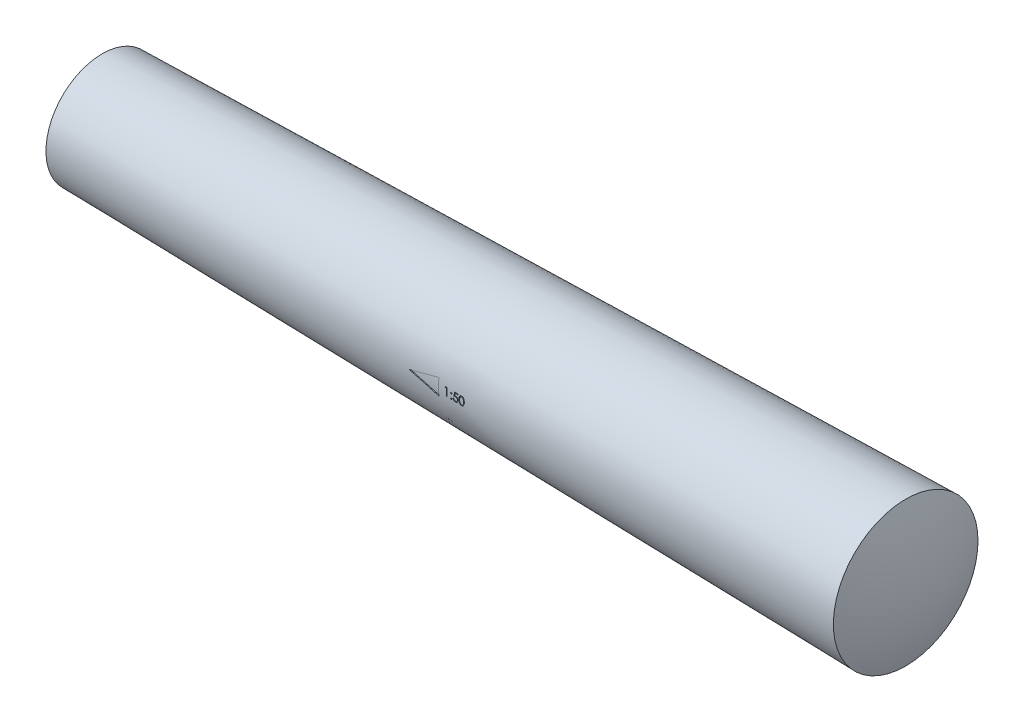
SolidWorks part; units mm, degrees
ref_plane "Front Plane" through (0, 0, 0) normal (0, 0, 1) x (1, 0, 0)
ref_plane "Top Plane" through (0, 0, 0) normal (0, 1, 0) x (1, 0, 0)
ref_plane "Right Plane" through (0, 0, 0) normal (1, 0, 0) x (0, 0, -1)
sketch "Sketch1" plane through (0, 0, 0) normal (1, 0, 0) x (0, 0, -1)
  circle A0 centre (0, 0) radius 7
  dimension "D1" = 14
extrude "Extrude1" add sketch "Sketch1" along normal mid plane 100
draft "Draft1" type of draft neutral plane draft angle 1.146 faces to draft 1 parameters "D1"=1.146
sketch "Sketch2" plane through (0, 0, 0) normal (0, 0, 1) x (1, 0, 0)
  line L0 (-50, 0) -> (-50, 7)
  line L1 (-50, 7) -> (-50, -7) construction
  line L2 (-50, 0) -> (-51.6, 0)
  line L3 (-51.6, 0) -> (-51.6, -8) construction
  line L4 (50, 0) -> (50, 9.0001)
  line L5 (50, -9.0001) -> (50, 9.0001) construction
  line L6 (50, 0) -> (51.6, 0)
  line L7 (51.6, 0) -> (51.6, -8) construction
  line L8 (-50, -7) -> (50, -9.0001) construction
  arc A0 (-51.6, 0) -> (-50, 7) centre (-35.4875, 0) cw
  arc A1 (51.6, 0) -> (50, 9.0001) centre (25.4871, 0) ccw
  point P14 (0, -8)
revolve "Revolve1" add sketch "Sketch2" angle 360 about L2
sketch "Sketch5" plane through (0, 0, 0) normal (0, 0, 1) x (1, 0, 0)
  line L0 (0, 8) -> (0, -8) construction
  line L1 (50, 9.0001) -> (-50, 7) construction
  line L2 (-50, -7) -> (50, -9.0001) construction
ref_plane "Plane2" through (0, 0, 0) normal (-0.02, 0, 0.9998) x (0.9998, 0, 0.02)
sketch "Sketch6" plane through (0, 0, 0) normal (-0.02, 0, 0.9998) x (0.9998, 0, 0.02)
  line L0 (0, 0) -> (0, 1)
  line L1 (0, 8) -> (0, -8) construction
  line L2 (0, 1) -> (-3.7321, 0)
  line L3 (-3.7321, 0) -> (0, -1)
  line L4 (0, -1) -> (0, 0)
  line L5 (0, -0.5) -> (4, -0.5) construction
  text T0 "1:50" font "Century Gothic" height 1
  dimension "D1" = 2
  dimension "D2" = 30
  dimension "D3" = 4
wrap "Wrap2" sketch "Sketch6" wrap type deboss source sketch "Sketch6" thickness 0.1 parameters "D1"=0.1
equation "\"D2@Sketch2\" = \"D1@Sketch2\""
